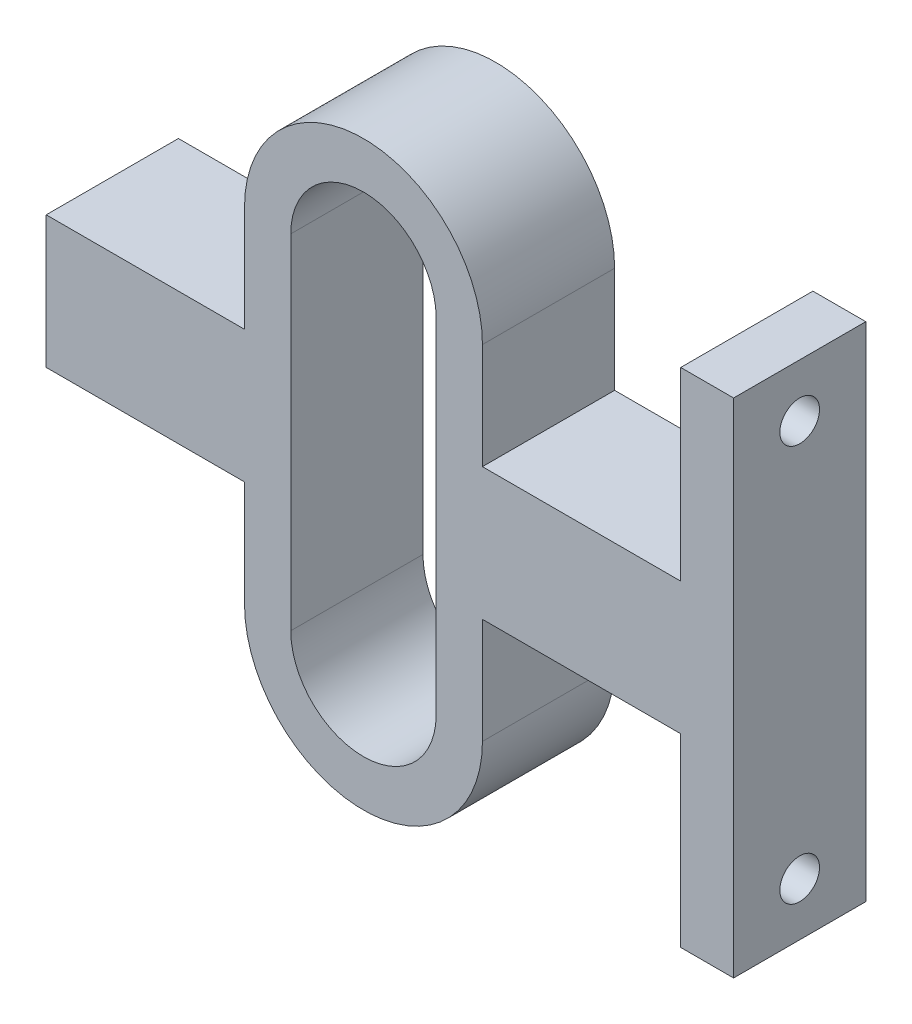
SolidWorks part; units mm, degrees
ref_plane "Front Plane" through (0, 0, 0) normal (0, 0, 1) x (1, 0, 0)
ref_plane "Top Plane" through (0, 0, 0) normal (0, 1, 0) x (1, 0, 0)
ref_plane "Right Plane" through (0, 0, 0) normal (1, 0, 0) x (0, 0, -1)
sketch "Sketch1" plane through (0, 0, 0) normal (0, 0, 1) x (1, 0, 0)
  line L0 (-5.5, 13) -> (-5.5, -13)
  line L4 (-24, 0) -> (67.4758, 0) construction
  line L5 (-9, 5) -> (-9, 13)
  line L7 (5.5, 13) -> (5.5, -13)
  line L10 (-9, -13) -> (-9, -5)
  line L11 (9, -13) -> (9, -5)
  line L14 (-24, -5) -> (-24, 5)
  line L15 (-9, 5) -> (-24, 5)
  line L16 (-9, -5) -> (-24, -5)
  line L19 (9, 5) -> (9, 13)
  line L26 (9, 5) -> (24, 5)
  line L29 (24, 5) -> (24, 19)
  line L30 (24, 19) -> (28, 19)
  line L34 (28, 19) -> (28, -19)
  line L35 (24, -19) -> (28, -19)
  line L36 (24, -5) -> (24, -19)
  line L37 (9, -5) -> (24, -5)
  line L38 (0, -22) -> (0, 22) construction
  arc A4 (-9, -13) -> (9, -13) centre (0, -13) ccw
  arc A5 (9, 13) -> (-9, 13) centre (0, 13) ccw
  arc A10 (5.5, 13) -> (-5.5, 13) centre (0, 13) ccw
  arc A11 (5.5, -13) -> (-5.5, -13) centre (0, -13) cw
  point P12 (28, 0)
  dimension "D3" = 9
  dimension "D5" = 15
  dimension "D1" = 5.5
  dimension "D2" = 4
  dimension "D4" = 15
  dimension "D6" = 10
extrude "Boss-Extrude1" add sketch "Sketch1" along normal blind 10
sketch "Sketch7" plane through (28, 0, 0) normal (1, 0, 0) x (0, 0, -1)
  line L0 (-10, 0) -> (2.9892, 0) construction
  line L1 (-10, -19) -> (-10, 19) construction
  line L2 (-5, 19) -> (-5, -19) construction
  line L3 (-10, 19) -> (0, 19) construction
  line L4 (-10, -19) -> (0, -19) construction
  circle A0 centre (-5, 15) radius 1.5
  circle A1 centre (-5, -15) radius 1.5
  dimension "D1" = 3
  dimension "D2" = 4
extrude "Cut-Extrude1" cut sketch "Sketch7" against normal blind 10
